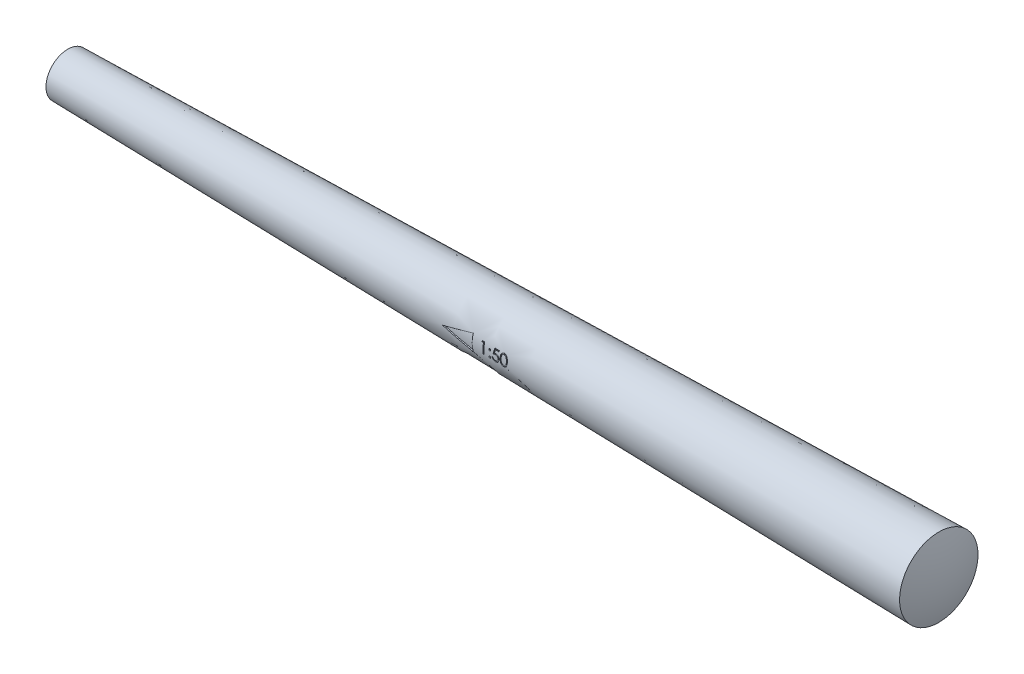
SolidWorks part; units mm, degrees
ref_plane "Front Plane" through (0, 0, 0) normal (0, 0, 1) x (1, 0, 0)
ref_plane "Top Plane" through (0, 0, 0) normal (0, 1, 0) x (1, 0, 0)
ref_plane "Right Plane" through (0, 0, 0) normal (1, 0, 0) x (0, 0, -1)
sketch "Sketch1" plane through (0, 0, 0) normal (1, 0, 0) x (0, 0, -1)
  circle A0 centre (0, 0) radius 2
  dimension "D1" = 4
extrude "Extrude1" add sketch "Sketch1" along normal mid plane 80
draft "Draft1" type of draft neutral plane draft angle 1.146 faces to draft 1 parameters "D1"=1.146
sketch "Sketch2" plane through (0, 0, 0) normal (0, 0, 1) x (1, 0, 0)
  line L0 (-40, 0) -> (-40, 2)
  line L1 (-40, 2) -> (-40, -2) construction
  line L2 (-40, 0) -> (-40.6, 0)
  line L3 (-40.6, 0) -> (-40.6, -2.8) construction
  line L4 (40, 0) -> (40, 3.6001)
  line L5 (40, -3.6001) -> (40, 3.6001) construction
  line L6 (40, 0) -> (40.6, 0)
  line L7 (40.6, 0) -> (40.6, -2.8) construction
  line L8 (-40, -2) -> (40, -3.6001) construction
  arc A0 (-40.6, 0) -> (-40, 2) centre (-36.9667, 0) cw
  arc A1 (40.6, 0) -> (40, 3.6001) centre (29.4997, 0) ccw
  point P14 (0, -2.8)
revolve "Revolve1" add sketch "Sketch2" angle 360 about L2
sketch "Sketch5" plane through (0, 0, 0) normal (0, 0, 1) x (1, 0, 0)
  line L0 (0, 2.8) -> (0, -2.8) construction
  line L1 (40, 3.6001) -> (-40, 2) construction
  line L2 (-40, -2) -> (40, -3.6001) construction
ref_plane "Plane2" through (0, 0, 0) normal (-0.02, 0, 0.9998) x (0.9998, 0, 0.02)
sketch "Sketch6" plane through (0, 0, 0) normal (-0.02, 0, 0.9998) x (0.9998, 0, 0.02)
  line L0 (0, 0) -> (0, 0.75)
  line L1 (0, 2.8) -> (0, -2.8) construction
  line L2 (0, 0.75) -> (-2.799, 0)
  line L3 (-2.799, 0) -> (0, -0.75)
  line L4 (0, -0.75) -> (0, 0)
  line L5 (0, -0.375) -> (4, -0.375) construction
  text T0 "1:50" font "Century Gothic" height 1
  dimension "D1" = 1.5
  dimension "D2" = 30
  dimension "D3" = 4
wrap "Wrap2" sketch "Sketch6" wrap type deboss source sketch "Sketch6" thickness 0.1 parameters "D1"=0.1
equation "\"D2@Sketch2\" = \"D1@Sketch2\""
